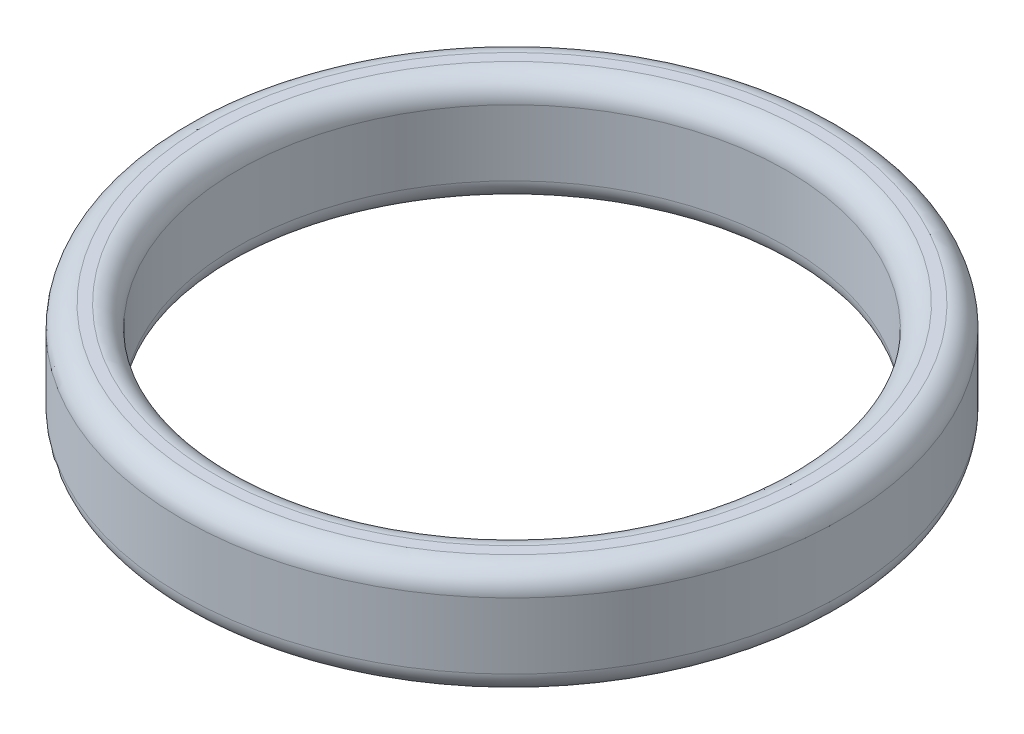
SolidWorks part; units mm, degrees
ref_plane "Face" through (0, 0, 0) normal (0, 0, 1) x (1, 0, 0)
ref_plane "dessus" through (0, 0, 0) normal (0, 1, 0) x (1, 0, 0)
ref_plane "Coté" through (0, 0, 0) normal (1, 0, 0) x (0, 0, -1)
sketch "Esquisse1" plane through (0, 0, 0) normal (0, 0, 1) x (1, 0, 0)
  line L0 (0, 0) -> (11.7506, 0) construction
  line L1 (0, 0) -> (0, 10.333) construction
  line L2 (5, 2.1) -> (5, 0.9)
  line L3 (5.4, 0.5) -> (5.6, 0.5)
  line L4 (5.4, 2.5) -> (5.6, 2.5)
  line L5 (6, 2.1) -> (6, 0.9)
  arc A1 (5, 2.1) -> (5.4, 2.5) centre (5.4, 2.1) cw
  arc A2 (5.4, 0.5) -> (5, 0.9) centre (5.4, 0.9) cw
  arc A3 (6, 0.9) -> (5.6, 0.5) centre (5.6, 0.9) cw
  arc A4 (6, 2.1) -> (5.6, 2.5) centre (5.6, 2.1) ccw
  dimension "D1" = 0.5
  dimension "D6" = 0.4
  dimension "D3" = 10
  dimension "D4" = 2
  dimension "D5" = 1
revolve "Base-Révolution" add sketch "Esquisse1" angle 360 about L1
